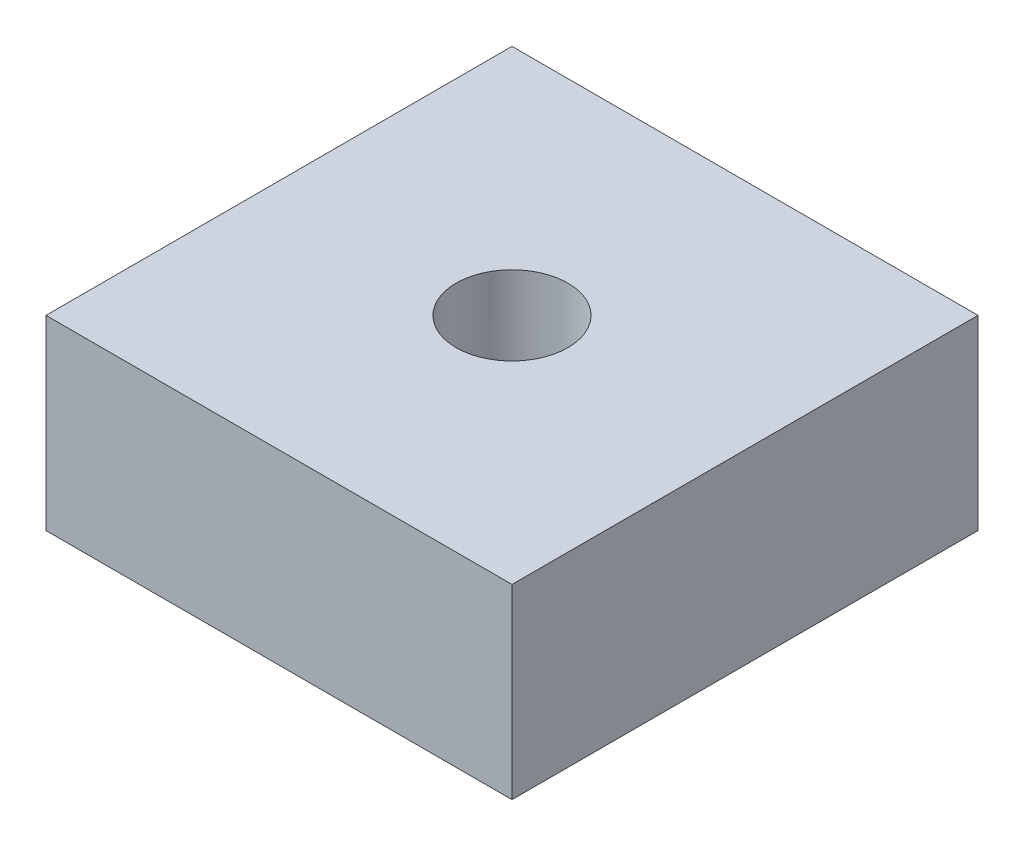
SolidWorks part; units mm, degrees
ref_plane "Front Plane" through (0, 0, 0) normal (0, 0, 1) x (1, 0, 0)
ref_plane "Top Plane" through (0, 0, 0) normal (0, 1, 0) x (1, 0, 0)
ref_plane "Right Plane" through (0, 0, 0) normal (1, 0, 0) x (0, 0, -1)
sketch "Sketch1" plane through (0, 0, 0) normal (0, 1, 0) x (1, 0, 0)
  line L1 (-12.5, -12.5) -> (12.5, -12.5)
  line L2 (-12.5, -12.5) -> (-12.5, 12.5)
  line L3 (-12.5, 12.5) -> (12.5, 12.5)
  line L4 (12.5, -12.5) -> (12.5, 12.5)
  line L5 (-12.5, -12.5) -> (12.5, 12.5) construction
  line L6 (-12.5, 12.5) -> (12.5, -12.5) construction
  point P0 (0, 0)
  dimension "D1" = 25
extrude "Boss-Extrude1" add sketch "Sketch1" along normal blind 10
sketch "Sketch2" plane through (0, 10, 0) normal (0, 1, 0) x (1, 0, 0)
  circle A0 centre (0, 0) radius 3
  dimension "D1" = 6
extrude "Cut-Extrude1" cut sketch "Sketch2" against normal up to next
